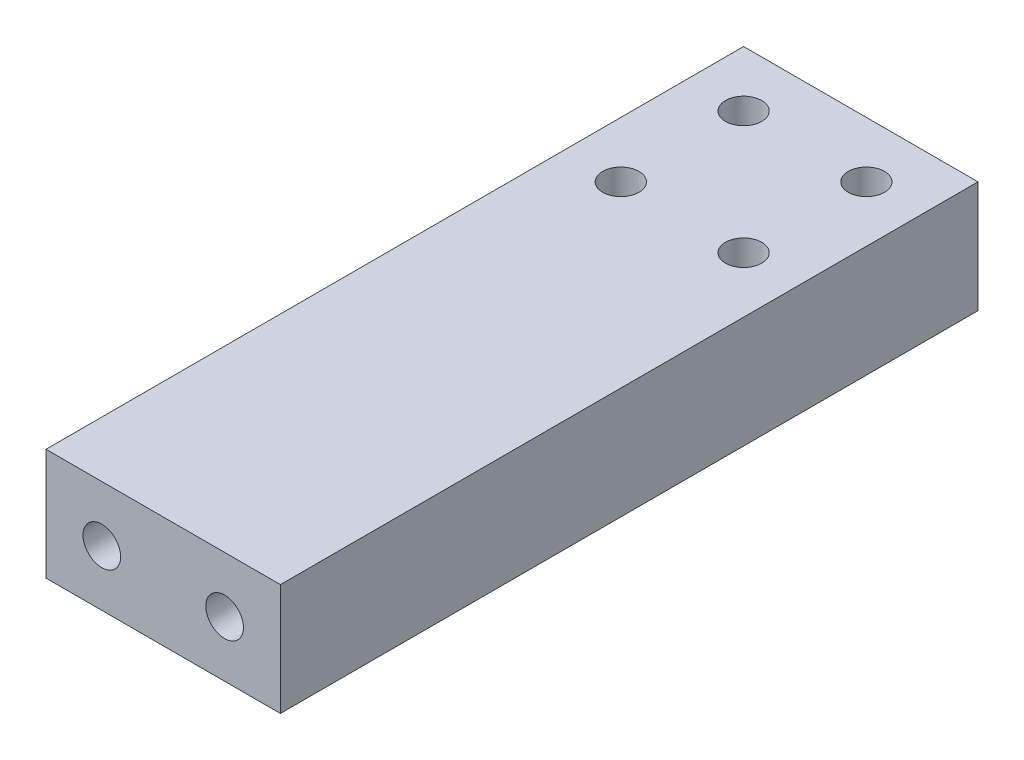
SolidWorks part; units mm, degrees
ref_plane "Plan1" through (0, 0, 0) normal (0, 0, 1) x (1, 0, 0)
ref_plane "Plan2" through (0, 0, 0) normal (0, 1, 0) x (1, 0, 0)
ref_plane "Plan3" through (0, 0, 0) normal (1, 0, 0) x (0, 0, -1)
sketch "Esquisse1" plane through (0, 0, 0) normal (0, 0, 1) x (1, 0, 0)
  line L1 (0, 0) -> (42, 0)
  line L2 (0, 0) -> (0, 20)
  line L3 (0, 20) -> (42, 20)
  line L4 (42, 0) -> (42, 20)
  dimension "D1" = 42
  dimension "D2" = 20
extrude "Base-Extrusion" add sketch "Esquisse1" along normal blind 125
sketch "Esquisse2" plane through (0, 20, 0) normal (0, 1, 0) x (-1, 0, 0)
  line L0 (0, 125) -> (0, 0) construction
  line L1 (-42, 125) -> (0, 125) construction
  line L2 (-10, 10) -> (-32, 10) construction
  line L3 (-10, 10) -> (-10, 32) construction
  circle A0 centre (-10, 10) radius 3.25
  circle A1 centre (-32, 10) radius 3.25
  circle A2 centre (-10, 32) radius 3.25
  circle A3 centre (-32, 32) radius 3.25
  dimension "D1" = 6.5
  dimension "D2" = 10
  dimension "D3" = 115
  dimension "D4" = 90
extrude "Enlèv. mat.-Extru.1" cut sketch "Esquisse2" against normal up to next
sketch "Esquisse3" plane through (0, 0, 125) normal (0, 0, 1) x (1, 0, 0)
  line L0 (0, 20) -> (0, 0) construction
  line L1 (0, 0) -> (42, 0) construction
  circle A0 centre (10, 10) radius 3.375
  circle A1 centre (32, 10) radius 3.375
  dimension "D1" = 6.75
  dimension "D2" = 6.75
  dimension "D3" = 22
  dimension "D4" = 10
  dimension "D5" = 10
  dimension "D6" = 10
extrude "Enlèv. mat.-Extru.2" cut sketch "Esquisse3" against normal blind 25
